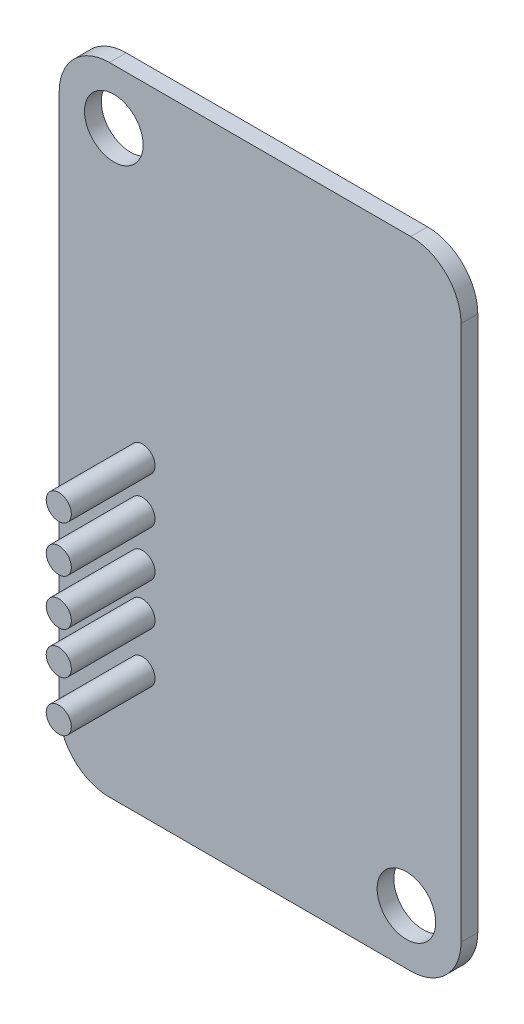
SolidWorks part; units mm, degrees
ref_plane "Plan de face" through (0, 0, 0) normal (0, 0, 1) x (1, 0, 0)
ref_plane "Plan de dessus" through (0, 0, 0) normal (0, 1, 0) x (1, 0, 0)
ref_plane "Plan de droite" through (0, 0, 0) normal (1, 0, 0) x (0, 0, -1)
sketch "Esquisse1" plane through (0, 0, 0) normal (0, 0, 1) x (1, 0, 0)
  line L0 (-12, 17) -> (-12, -21)
  line L1 (-12, 17) -> (12, 17)
  line L2 (-12, -21) -> (12, -21)
  line L3 (12, 17) -> (12, -21)
  point P7 (7.5991, -0.5238)
  dimension "D1" = 24
  dimension "D2" = 38
  dimension "D3" = 17
  dimension "D4" = 12
extrude "Boss.-Extru.1" add sketch "Esquisse1" along normal blind 1
fillet "Congé1" radius 3 4 edges at (-12, -21, 0.5) (12, -21, 0.5) (-12, 17, 0.5) (12, 17, 0.5)
sketch "Esquisse2" plane through (0, 0, 0) normal (0, 0, -1) x (-1, 0, 0)
  line L0 (3, 1.5) -> (3, -1.5)
  line L1 (3, 1.5) -> (7, 1.5)
  line L2 (3, -1.5) -> (7, -1.5)
  line L3 (7, 1.5) -> (7, -1.5)
  line L4 (-1.5, 3) -> (1.5, 3)
  line L5 (-1.5, 3) -> (-1.5, 7)
  line L6 (1.5, 3) -> (1.5, 7)
  line L7 (-1.5, 7) -> (1.5, 7)
  line L8 (-3, 1.5) -> (-3, -1.5)
  line L9 (-3, 1.5) -> (-7, 1.5)
  line L10 (-3, -1.5) -> (-7, -1.5)
  line L11 (-7, 1.5) -> (-7, -1.5)
  line L12 (-1.5, -3) -> (1.5, -3)
  line L13 (-1.5, -3) -> (-1.5, -7)
  line L14 (1.5, -3) -> (1.5, -7)
  line L15 (-1.5, -7) -> (1.5, -7)
  line L16 (7, 0) -> (-7, 0) construction
  line L18 (0, 7) -> (0, -7) construction
  dimension "D1" = 4
  dimension "D2" = 14
  dimension "D3" = 3
extrude "Boss.-Extru.2" add sketch "Esquisse2" along normal blind 2
sketch "Esquisse3" plane through (0, 0, 0) normal (0, 0, -1) x (-1, 0, 0)
  line L0 (8.7372, 13.7372) -> (12, 13.7372) construction
  line L1 (12, 14) -> (12, -18) construction
  line L3 (-9, 17) -> (9, 17) construction
  line L4 (8.7372, 17) -> (8.7372, 13.7372) construction
  line L6 (-8.7372, -17.7372) -> (-8.7372, -21) construction
  line L7 (9, -21) -> (-9, -21) construction
  line L9 (-12, -18) -> (-12, 14) construction
  line L10 (-12, -17.7372) -> (-8.7372, -17.7372) construction
  circle A0 centre (8.7372, 13.7372) radius 1.75
  circle A1 centre (-8.7372, -17.7372) radius 1.75
  point P4 (4.9612, 13.2632)
  dimension "D2" = 3.5
  dimension "D1" = 36
extrude "Enlèv. mat.-Extru.1" cut sketch "Esquisse3" against normal through all
sketch "Esquisse4" plane through (0, 0, 0) normal (0, 0, -1) x (-1, 0, 0)
  line L0 (7.0257, -2.5) -> (7.0257, -13.5) construction
  line L1 (9, -21) -> (-9, -21) construction
  circle A0 centre (7.0257, -2.5) radius 0.75
  circle A1 centre (7.0257, -5.2557) radius 0.75
  circle A2 centre (7.0257, -8) radius 0.75
  circle A3 centre (7.0257, -10.5078) radius 0.75
  circle A4 centre (7.0257, -13.5) radius 0.75
  point P10 (7.0257, -10.6315)
  point P13 (7.0257, -10.5078)
  point P14 (7.0257, -5.2557)
  dimension "D1" = 1.5
  dimension "D2" = 7.5
  dimension "D3" = 18.5
extrude "Boss.-Extru.3" add sketch "Esquisse4" along normal blind 2 and the other way blind 6
